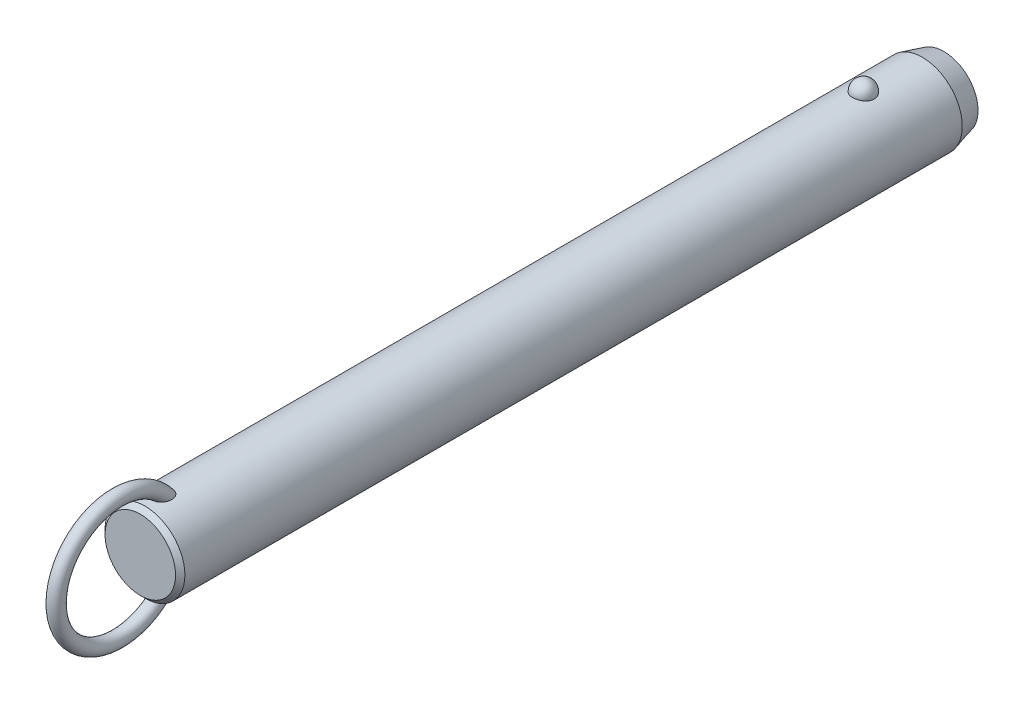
SolidWorks part; units mm, degrees
ref_plane "Front Plane" through (0, 0, 0) normal (0, 0, 1) x (1, 0, 0)
ref_plane "Top Plane" through (0, 0, 0) normal (0, 1, 0) x (1, 0, 0)
ref_plane "Right Plane" through (0, 0, 0) normal (1, 0, 0) x (0, 0, -1)
sketch "Sketch2" plane through (0, 0, 0) normal (0, 0, 1) x (1, 0, 0)
  circle A0 centre (0, 0) radius 11.1
  point P3 (0, 11.1)
  dimension "D1" = 22.2
extrude "Boss-Extrude1" add sketch "Sketch2" along normal blind 185.4
sketch "Sketch3" plane through (0, 0, 0) normal (0, 0, -1) x (-1, 0, 0)
  circle A0 centre (0, 0) radius 11.1
  dimension "D1" = 22.2
extrude "Boss-Extrude2" add sketch "Sketch3" along normal blind 25.4
chamfer "Chamfer1" distance 6 angle 15 1 edges at (-11.1, 0, -25.4)
sketch "Sketch12" plane through (0, 0, 0) normal (1, 0, 0) x (0, 0, -1)
  line L0 (-185.4, 11.1) -> (-185.4, -11.1) construction
  point P0 (-185.4, 0)
sketch "Sketch13" plane through (0, 0, 0) normal (1, 0, 0) x (0, 0, -1)
  circle A0 centre (-204.45, 0) radius 19.05
  point P2 (-185.4, 0)
  dimension "D1" = 38.1
sketch "Sketch14" plane through (0, 0, 0) normal (0, 1, 0) x (1, 0, 0)
  circle A0 centre (0, -187.4) radius 2
  point P2 (0, -185.4)
  dimension "D1" = 4
sweep "Sweep1" add profiles "Sketch14" path "Sketch13"
sketch "Sketch15" plane through (0, 0, 185.4) normal (0, 0, 1) x (1, 0, 0)
  circle A0 centre (0, 0) radius 11.1
  dimension "D1" = 22.2
extrude "Boss-Extrude3" add sketch "Sketch15" along normal blind 12.7
chamfer "Chamfer2" distance 1.3 angle 45 1 edges at (11.1, 0, 198.1)
sketch "Sketch18" plane through (0, 0, 0) normal (1, 0, 0) x (0, 0, -1)
  line L0 (19.4, 11.1) -> (-188.968, 11.1) construction
  line L1 (3, 14.1) -> (3, 8.1)
  line L2 (-188.968, -11.1) -> (19.4, -11.1) construction
  arc A0 (3, 14.1) -> (3, 8.1) centre (3, 11.1) ccw
  point P4 (0, 11.1)
  dimension "D1" = 25.2
revolve "Revolve1" add sketch "Sketch18" angle 360 about L1
